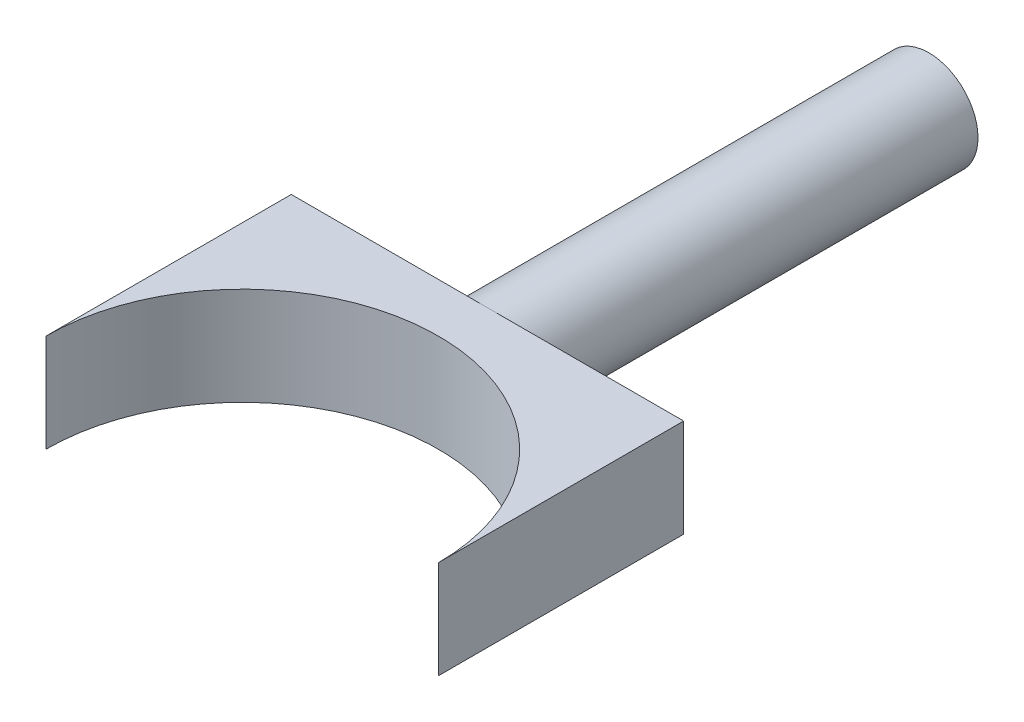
SolidWorks part; units mm, degrees
ref_plane "Front Plane" through (0, 0, 0) normal (0, 0, 1) x (1, 0, 0)
ref_plane "Top Plane" through (0, 0, 0) normal (0, 1, 0) x (1, 0, 0)
ref_plane "Right Plane" through (0, 0, 0) normal (1, 0, 0) x (0, 0, -1)
sketch "Sketch1" plane through (0, 0, 0) normal (0, 0, 1) x (1, 0, 0)
  circle A0 centre (0, 0) radius 5
  dimension "D1" = 10
extrude "Boss-Extrude1" add sketch "Sketch1" along normal blind 45
sketch "Sketch2" plane through (0, 0, 45) normal (0, 0, 1) x (1, 0, 0)
  line L1 (-20, -4.9955) -> (20, -4.9955)
  line L2 (-20, -4.9955) -> (-20, 4.9955)
  line L3 (-20, 4.9955) -> (20, 4.9955)
  line L4 (20, -4.9955) -> (20, 4.9955)
  line L5 (-20, -4.9955) -> (20, 4.9955) construction
  line L6 (-20, 4.9955) -> (20, -4.9955) construction
  point P0 (0, 0)
  dimension "D1" = 40
extrude "Boss-Extrude2" add sketch "Sketch2" along normal blind 25
sketch "Sketch4" plane through (0, 4.9955, 0) normal (0, 1, 0) x (1, 0, 0)
  line L0 (20, -70) -> (-20, -70) construction
  line L1 (-20, -70) -> (20, -70)
  arc A0 (20, -70) -> (-20, -70) centre (0, -70) ccw
  dimension "D1" = 40
extrude "Cut-Extrude1" cut sketch "Sketch4" against normal through all
